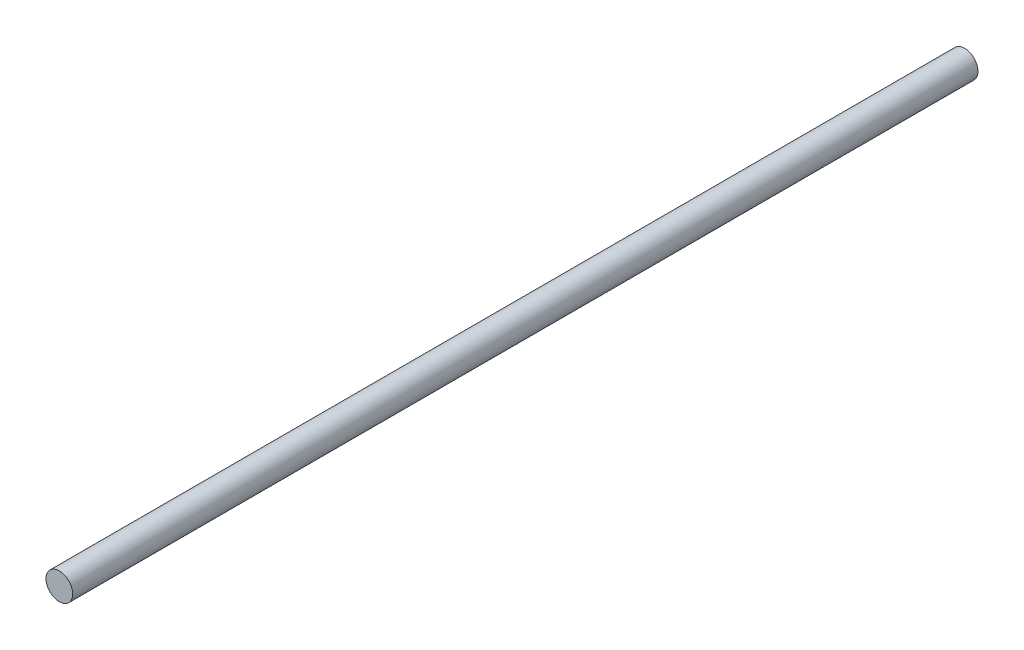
SolidWorks part; units mm, degrees
ref_plane "Спереди" through (0, 0, 0) normal (0, 0, 1) x (1, 0, 0)
ref_plane "Сверху" through (0, 0, 0) normal (0, 1, 0) x (1, 0, 0)
ref_plane "Справа" through (0, 0, 0) normal (1, 0, 0) x (0, 0, -1)
sketch "Эскиз1" plane through (0, 0, 0) normal (0, 0, 1) x (1, 0, 0)
  circle A0 centre (0, 0) radius 3.175
  dimension "D1" = 6.35
extrude "Бобышка-Вытянуть1" add sketch "Эскиз1" along normal blind 215
